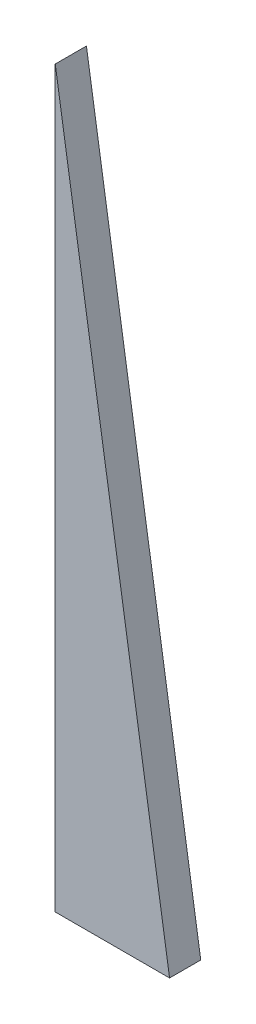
SolidWorks part; units mm, degrees
ref_plane "Front Plane" through (0, 0, 0) normal (0, 0, 1) x (1, 0, 0)
ref_plane "Top Plane" through (0, 0, 0) normal (0, 1, 0) x (1, 0, 0)
ref_plane "Right Plane" through (0, 0, 0) normal (1, 0, 0) x (0, 0, -1)
sketch "Sketch1" plane through (0, 0, 0) normal (0, 1, 0) x (1, 0, 0)
  line L1 (-74.7837, 2.7559) -> (64.9163, 2.7559)
  line L2 (-74.7837, 2.7559) -> (-74.7837, -35.3441)
  line L3 (-74.7837, -35.3441) -> (64.9163, -35.3441)
  line L4 (64.9163, 2.7559) -> (64.9163, -35.3441)
  dimension "D1" = 139.7
  dimension "D2" = 38.1
extrude "Boss-Extrude1" add sketch "Sketch1" along normal blind 897.382
sketch "Sketch2" plane through (0, 0, 35.3441) normal (0, 0, 1) x (1, 0, 0)
  line L0 (-74.7837, 897.382) -> (64.9163, 0)
  line L1 (-74.7837, 897.382) -> (64.9163, 897.382)
  line L2 (64.9163, 897.382) -> (64.9163, 0)
extrude "Cut-Extrude1" cut sketch "Sketch2" against normal blind 769.874
